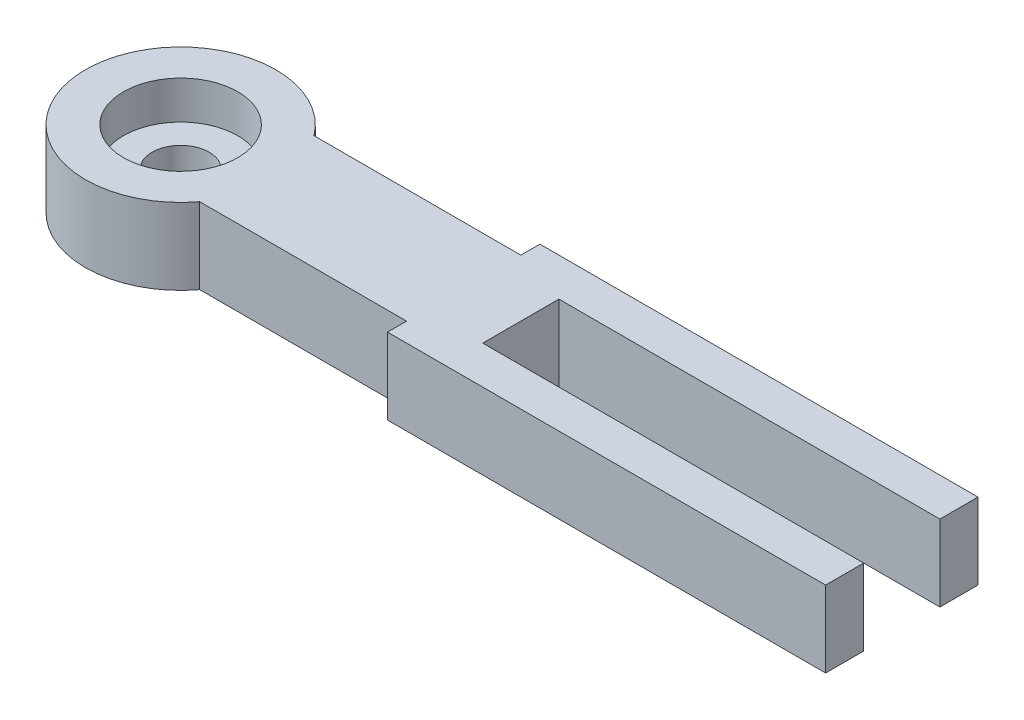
SolidWorks part; units mm, degrees
ref_plane "Plano frontal" through (0, 0, 0) normal (0, 0, 1) x (1, 0, 0)
ref_plane "Plano superior" through (0, 0, 0) normal (0, 1, 0) x (1, 0, 0)
ref_plane "Plano direito" through (0, 0, 0) normal (1, 0, 0) x (0, 0, -1)
sketch "Esboço1" plane through (0, 0, 0) normal (0, 1, 0) x (1, 0, 0)
  line L0 (62.1012, 5.1946) -> (62.1012, 4.1946)
  line L4 (62.1012, 10.1946) -> (62.1012, 9.1946)
  line L5 (42.1012, 5.1946) -> (62.1012, 5.1946)
  line L6 (42.1012, 5.1946) -> (42.1012, 9.1946)
  line L7 (42.1012, 9.1946) -> (62.1012, 9.1946)
  line L9 (39.1012, 11.1946) -> (62.1012, 11.1946)
  line L10 (39.1012, 11.1946) -> (39.1012, 10.1946)
  line L12 (62.1012, 11.1946) -> (62.1012, 10.1946)
  line L13 (39.1012, 3.1946) -> (62.1012, 3.1946)
  line L14 (39.1012, 3.1946) -> (39.1012, 4.1946)
  line L16 (62.1012, 3.1946) -> (62.1012, 4.1946)
  line L25 (28.2408, 4.1946) -> (39.1012, 4.1946)
  line L26 (28.2408, 10.1946) -> (39.1012, 10.1946)
  circle A0 centre (24.2408, 7.1946) radius 1.5
  arc A1 (28.2408, 10.1946) -> (28.2408, 4.1946) centre (24.2408, 7.1946) ccw
  point P4 (62.1012, 7.1946)
  point P5 (62.1012, 9.1946)
  point P6 (62.1012, 5.1946)
  point P7 (42.1012, 5.1946)
  point P12 (39.1012, 10.1946)
  point P13 (39.1012, 11.1946)
  point P15 (39.1012, 4.1946)
  point P18 (39.1012, 3.1946)
  point P28 (32.1012, 10.1946)
  dimension "D1" = 3
  dimension "D2" = 10
  dimension "D3" = 2
  dimension "D4" = 2
  dimension "D5" = 20
  dimension "D6" = 3
  dimension "D7" = 1
  dimension "D8" = 1
extrude "Ressalto-extrusão1" add sketch "Esboço1" along normal blind 4 contours A0 | L26 L10 L9 L12 L4 L7 L6 L5 L0 L16 L13 L14 L25 A1
sketch "Esboço2" plane through (0, 4, 0) normal (0, 1, 0) x (1, 0, 0)
  circle A0 centre (24.2408, 7.1946) radius 1.5
  circle A1 centre (24.2408, 7.1946) radius 3
  dimension "D1" = 6
extrude "Corte-extrusão1" cut sketch "Esboço2" against normal blind 2
